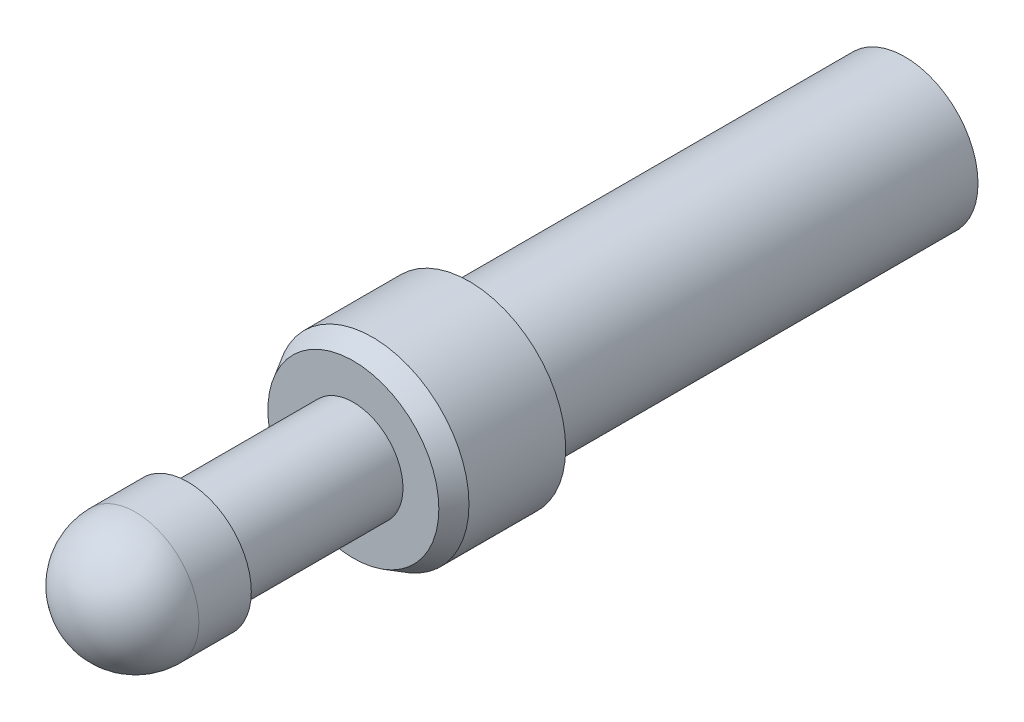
SolidWorks part; units mm, degrees
ref_plane "Face" through (0, 0, 0) normal (0, 0, 1) x (1, 0, 0)
ref_plane "Dessus" through (0, 0, 0) normal (0, 1, 0) x (1, 0, 0)
ref_plane "Droite" through (0, 0, 0) normal (1, 0, 0) x (0, 0, -1)
sketch "Esquisse1" plane through (0, 0, 0) normal (0, 0, 1) x (1, 0, 0)
  circle A0 centre (0, 0) radius 1.325
extrude "Extrusion1" add sketch "Esquisse1" along normal blind 7.9
sketch "Esquisse2" plane through (0, 0, 7.9) normal (0, 0, 1) x (1, 0, 0)
  circle A0 centre (0, 0) radius 1.75
extrude "Extrusion2" add sketch "Esquisse2" along normal blind 2.1
sketch "Esquisse3" plane through (0, 0, 10) normal (0, 0, 1) x (1, 0, 0)
  circle A0 centre (0, 0) radius 0.9
extrude "Extrusion3" add sketch "Esquisse3" along normal blind 3
sketch "Esquisse4" plane through (0, 0, 13) normal (0, 0, 1) x (1, 0, 0)
  circle A0 centre (0, 0) radius 1.15
extrude "Extrusion4" add sketch "Esquisse4" along normal blind 2.1
fillet "Congé1" radius 1.15 1 edges at (1.15, 0, 15.1)
chamfer "Chanfrein1" distance 0.2 angle 60 1 edges at (1.75, 0, 10)
